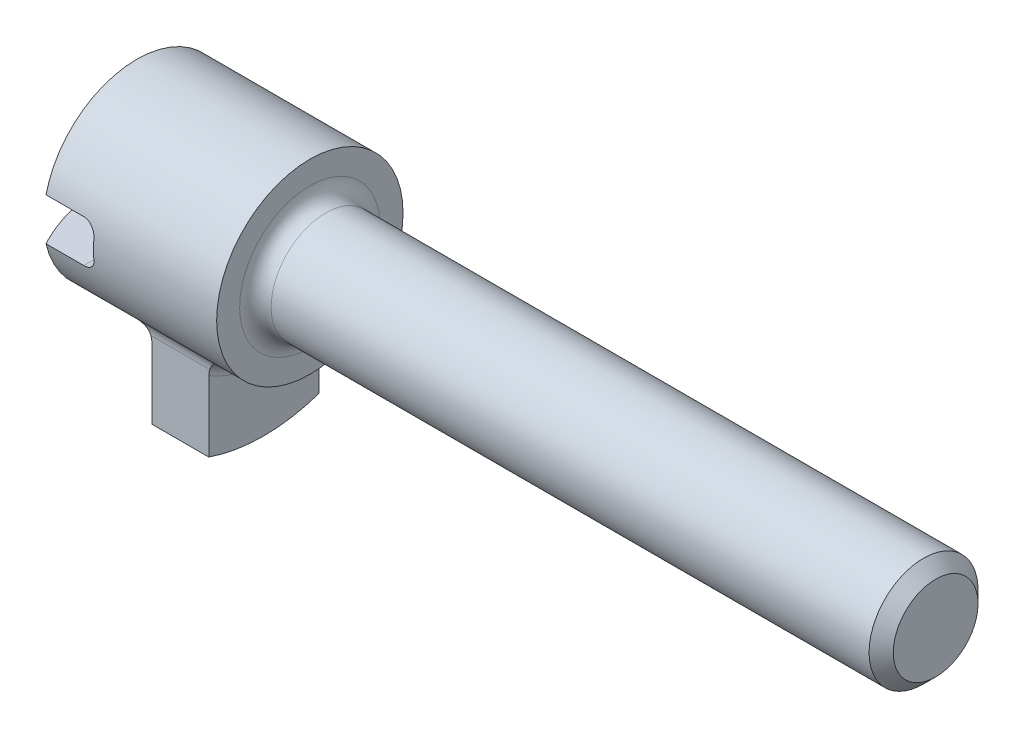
SolidWorks part; units mm, degrees
ref_plane "Front Plane" through (0, 0, 0) normal (0, 0, 1) x (1, 0, 0)
ref_plane "Top Plane" through (0, 0, 0) normal (0, 1, 0) x (1, 0, 0)
ref_plane "Right Plane" through (0, 0, 0) normal (1, 0, 0) x (0, 0, -1)
sketch "Sketch1" plane through (0, 0, 0) normal (0, 0, 1) x (1, 0, 0)
  line L0 (0, 0) -> (57.7411, 0) construction
  line L1 (0, 0) -> (0, 1.9558)
  line L2 (0, 1.9558) -> (3.6322, 1.9558)
  line L3 (3.6322, 1.9558) -> (3.6322, 1.4732)
  line L4 (3.9624, 1.143) -> (16.51, 1.143)
  line L5 (16.764, 0.889) -> (16.764, 0)
  line L6 (16.764, 0) -> (0, 0)
  line L7 (16.51, 1.143) -> (16.764, 0.889)
  line L8 (-0.5016, 0) -> (0, 0)
  arc A0 (3.9624, 1.143) -> (3.6322, 1.4732) centre (3.9624, 1.4732) cw
  arc A1 (0, 1.9558) -> (-0.5016, 0) centre (3.5624, 0) ccw
  point P8 (16.764, 1.143)
  dimension "D5" = 0.3302
  dimension "D6" = 4.064
  dimension "D1" = 2.286
  dimension "D2" = 3.9116
  dimension "D3" = 3.6322
  dimension "D4" = 16.764
revolve "Revolve1" add sketch "Sketch1" angle 360 about L0
sketch "Sketch2" plane through (0, 0, 0) normal (0, 0, 1) x (1, 0, 0)
  line L0 (-0.4772, 0.4445) -> (0.7928, 0.4445)
  line L1 (1.0468, 0.1905) -> (1.0468, -0.1905)
  line L2 (0.7928, -0.4445) -> (-0.4772, -0.4445)
  arc A0 (0, 1.9558) -> (0, -1.9558) centre (3.5624, 0) ccw construction
  arc A1 (1.0468, 0.1905) -> (0.7928, 0.4445) centre (0.7928, 0.1905) ccw
  arc A2 (1.0468, -0.1905) -> (0.7928, -0.4445) centre (0.7928, -0.1905) cw
  arc A3 (-0.4772, 0.4445) -> (-0.4772, -0.4445) centre (3.5624, 0) ccw
  point P7 (1.0468, 0)
  point P11 (1.0468, 0.4445)
  point P14 (1.0468, -0.4445)
  dimension "D3" = 0.254
  dimension "D1" = 1.524
  dimension "D2" = 0.889
extrude "Cut-Extrude1" cut sketch "Sketch2" against normal mid plane 10.16
sketch "Sketch4" plane through (0, 0, 0) normal (0, 0, 1) x (1, 0, 0)
  line L0 (1.4732, 0) -> (1.4732, -3.556)
  line L1 (1.4732, -3.556) -> (2.667, -3.556)
  line L2 (2.667, -3.556) -> (2.667, 0)
  line L3 (2.667, 0) -> (1.4732, 0)
  line L4 (3.6322, -1.9558) -> (3.6322, 1.9558) construction
  dimension "D1" = 0.9652
  dimension "D2" = 1.1938
  dimension "D3" = 3.556
extrude "Boss-Extrude1" add sketch "Sketch4" along normal mid plane 2.3114
sketch "Sketch7" plane through (1.4732, 0, 0) normal (-1, 0, 0) x (0, 0, 1)
  line L0 (1.1557, -3.556) -> (-1.1557, -3.556) construction
  line L1 (1.1557, -1.5778) -> (1.1557, -3.556) construction
  line L2 (-1.1557, -1.5778) -> (-1.1557, -3.556) construction
  line L3 (-1.1557, -3.556) -> (1.1557, -3.556) construction
  line L4 (1.1557, -3.556) -> (1.1557, -1.5778) construction
  line L5 (-1.1557, -3.363) -> (-1.1557, -3.556)
  line L6 (-1.1557, -3.556) -> (1.1557, -3.556)
  line L7 (1.1557, -3.556) -> (1.1557, -3.363)
  arc A0 (-1.1557, -3.363) -> (1.1557, -3.363) centre (0, 0) ccw
extrude "Cut-Extrude3" cut sketch "Sketch7" against normal through all contours A0 M2 M3 | A0 L6 M4
fillet "Fillet1" radius 0.381 2 edges at (2.0701, -1.5778, -1.1557) (2.0701, -1.5778, 1.1557)
fillet "Fillet2" radius 0.254 2 edges at (2.667, -1.9558, 0) (1.4732, -1.9558, 0)
